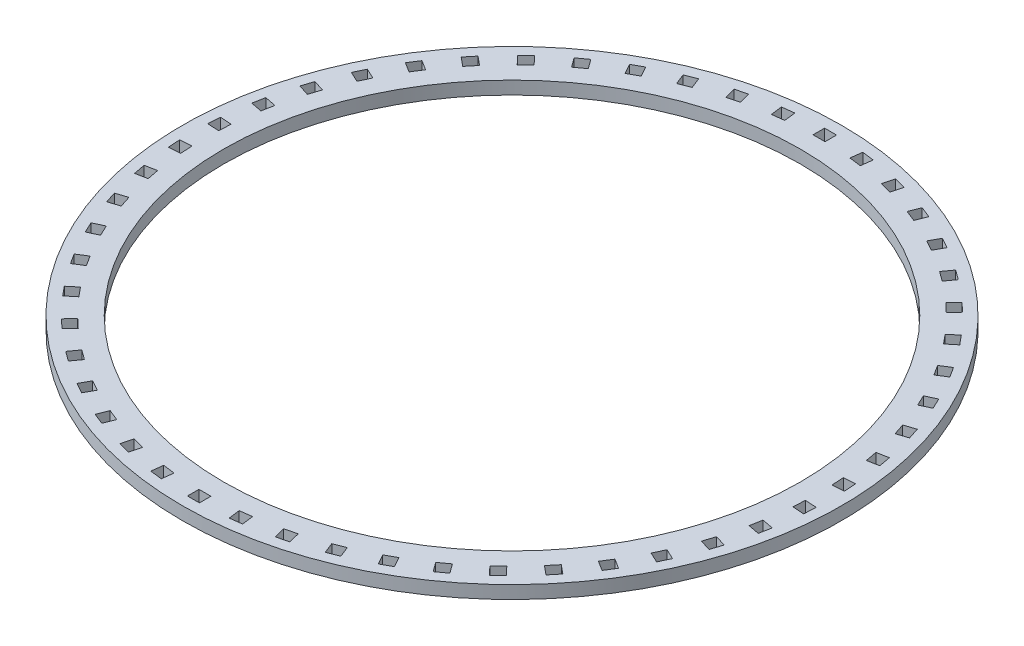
SolidWorks part; units mm, degrees
ref_plane "Front Plane" through (0, 0, 0) normal (0, 0, 1) x (1, 0, 0)
ref_plane "Top Plane" through (0, 0, 0) normal (0, 1, 0) x (1, 0, 0)
ref_plane "Right Plane" through (0, 0, 0) normal (1, 0, 0) x (0, 0, -1)
sketch "Sketch1" plane through (0, 0, 0) normal (0, 1, 0) x (1, 0, 0)
  line L0 (0, 0) -> (0, 76.2) construction
  line L1 (16.9777, 71.6901) -> (16.3144, 69.1069)
  line L2 (-1.3843, 73.66) -> (1.3843, 73.66)
  line L3 (-1.3843, 73.66) -> (-1.3843, 70.993)
  line L4 (-1.3843, 70.993) -> (1.3843, 70.993)
  line L5 (1.3843, 73.66) -> (1.3843, 70.993)
  line L6 (-1.3843, 73.66) -> (1.3843, 70.993) construction
  line L7 (-1.3843, 70.993) -> (1.3843, 73.66) construction
  line L8 (16.9777, 71.6901) -> (19.6593, 71.0016)
  line L9 (19.6593, 71.0016) -> (18.9961, 68.4184)
  line L10 (16.3144, 69.1069) -> (18.9961, 68.4184)
  line L11 (34.2729, 65.2156) -> (32.9881, 62.8785)
  line L12 (34.2729, 65.2156) -> (36.699, 63.8819)
  line L13 (36.699, 63.8819) -> (35.4142, 61.5447)
  line L14 (32.9881, 62.8785) -> (35.4142, 61.5447)
  line L15 (49.4146, 54.6434) -> (47.5889, 52.6993)
  line L16 (49.4146, 54.6434) -> (51.4329, 52.7482)
  line L17 (51.4329, 52.7482) -> (49.6072, 50.8041)
  line L18 (47.5889, 52.6993) -> (49.6072, 50.8041)
  line L19 (61.4514, 40.6378) -> (59.1996, 39.2088)
  line L20 (61.4514, 40.6378) -> (62.9349, 38.3002)
  line L21 (62.9349, 38.3002) -> (60.6831, 36.8711)
  line L22 (59.1996, 39.2088) -> (60.6831, 36.8711)
  line L23 (69.6271, 24.0787) -> (67.0906, 23.2546)
  line L24 (69.6271, 24.0787) -> (70.4826, 21.4456)
  line L25 (70.4826, 21.4456) -> (67.9461, 20.6215)
  line L26 (67.0906, 23.2546) -> (67.9461, 20.6215)
  line L27 (73.4277, 6.0067) -> (70.766, 5.8393)
  line L28 (73.4277, 6.0067) -> (73.6016, 3.2436)
  line L29 (73.6016, 3.2436) -> (70.9398, 3.0761)
  line L30 (70.766, 5.8393) -> (70.9398, 3.0761)
  line L31 (72.6147, -12.4427) -> (69.9949, -11.943)
  line L32 (72.6147, -12.4427) -> (72.0959, -15.1623)
  line L33 (72.0959, -15.1623) -> (69.4761, -14.6625)
  line L34 (69.9949, -11.943) -> (69.4761, -14.6625)
  line L35 (67.239, -30.1104) -> (64.8258, -28.9748)
  line L36 (67.239, -30.1104) -> (66.0602, -32.6155)
  line L37 (66.0602, -32.6155) -> (63.647, -31.4799)
  line L38 (64.8258, -28.9748) -> (63.647, -31.4799)
  line L39 (57.6384, -45.886) -> (55.5834, -44.186)
  line L40 (57.6384, -45.886) -> (55.8736, -48.0193)
  line L41 (55.8736, -48.0193) -> (53.8187, -46.3193)
  line L42 (55.5834, -44.186) -> (53.8187, -46.3193)
  line L43 (44.4162, -58.7785) -> (42.8486, -56.6209)
  line L44 (44.4162, -58.7785) -> (42.1763, -60.4059)
  line L45 (42.1763, -60.4059) -> (40.6087, -58.2482)
  line L46 (42.8486, -56.6209) -> (40.6087, -58.2482)
  line L47 (28.4031, -67.9777) -> (27.4214, -65.498)
  line L48 (28.4031, -67.9777) -> (25.829, -68.9969)
  line L49 (25.829, -68.9969) -> (24.8472, -66.5172)
  line L50 (27.4214, -65.498) -> (24.8472, -66.5172)
  line L51 (10.6054, -72.9057) -> (10.2712, -70.2597)
  line L52 (10.6054, -72.9057) -> (7.8587, -73.2527)
  line L53 (7.8587, -73.2527) -> (7.5244, -70.6067)
  line L54 (10.2712, -70.2597) -> (7.5244, -70.6067)
  line L55 (-7.8587, -73.2527) -> (-7.5244, -70.6067)
  line L56 (-7.8587, -73.2527) -> (-10.6054, -72.9057)
  line L57 (-10.6054, -72.9057) -> (-10.2712, -70.2597)
  line L58 (-7.5244, -70.6067) -> (-10.2712, -70.2597)
  line L59 (-25.829, -68.9969) -> (-24.8472, -66.5172)
  line L60 (-25.829, -68.9969) -> (-28.4031, -67.9777)
  line L61 (-28.4031, -67.9777) -> (-27.4214, -65.498)
  line L62 (-24.8472, -66.5172) -> (-27.4214, -65.498)
  line L63 (-42.1763, -60.4059) -> (-40.6087, -58.2482)
  line L64 (-42.1763, -60.4059) -> (-44.4162, -58.7785)
  line L65 (-44.4162, -58.7785) -> (-42.8486, -56.6209)
  line L66 (-40.6087, -58.2482) -> (-42.8486, -56.6209)
  line L67 (-55.8736, -48.0193) -> (-53.8187, -46.3193)
  line L68 (-55.8736, -48.0193) -> (-57.6384, -45.886)
  line L69 (-57.6384, -45.886) -> (-55.5834, -44.186)
  line L70 (-53.8187, -46.3193) -> (-55.5834, -44.186)
  line L71 (-66.0602, -32.6155) -> (-63.647, -31.4799)
  line L72 (-66.0602, -32.6155) -> (-67.239, -30.1104)
  line L73 (-67.239, -30.1104) -> (-64.8258, -28.9748)
  line L74 (-63.647, -31.4799) -> (-64.8258, -28.9748)
  line L75 (-72.0959, -15.1623) -> (-69.4761, -14.6625)
  line L76 (-72.0959, -15.1623) -> (-72.6147, -12.4427)
  line L77 (-72.6147, -12.4427) -> (-69.9949, -11.943)
  line L78 (-69.4761, -14.6625) -> (-69.9949, -11.943)
  line L79 (-73.6016, 3.2436) -> (-70.9398, 3.0761)
  line L80 (-73.6016, 3.2436) -> (-73.4277, 6.0067)
  line L81 (-73.4277, 6.0067) -> (-70.766, 5.8393)
  line L82 (-70.9398, 3.0761) -> (-70.766, 5.8393)
  line L83 (-70.4826, 21.4456) -> (-67.9461, 20.6215)
  line L84 (-70.4826, 21.4456) -> (-69.6271, 24.0787)
  line L85 (-69.6271, 24.0787) -> (-67.0906, 23.2546)
  line L86 (-67.9461, 20.6215) -> (-67.0906, 23.2546)
  line L87 (-62.9349, 38.3002) -> (-60.6831, 36.8711)
  line L88 (-62.9349, 38.3002) -> (-61.4514, 40.6378)
  line L89 (-61.4514, 40.6378) -> (-59.1996, 39.2088)
  line L90 (-60.6831, 36.8711) -> (-59.1996, 39.2088)
  line L91 (-51.4329, 52.7482) -> (-49.6072, 50.8041)
  line L92 (-51.4329, 52.7482) -> (-49.4146, 54.6434)
  line L93 (-49.4146, 54.6434) -> (-47.5889, 52.6993)
  line L94 (-49.6072, 50.8041) -> (-47.5889, 52.6993)
  line L95 (-36.699, 63.8819) -> (-35.4142, 61.5447)
  line L96 (-36.699, 63.8819) -> (-34.2729, 65.2156)
  line L97 (-34.2729, 65.2156) -> (-32.9881, 62.8785)
  line L98 (-35.4142, 61.5447) -> (-32.9881, 62.8785)
  line L99 (-19.6593, 71.0016) -> (-18.9961, 68.4184)
  line L100 (-19.6593, 71.0016) -> (-16.9777, 71.6901)
  line L101 (-16.9777, 71.6901) -> (-16.3144, 69.1069)
  line L102 (-18.9961, 68.4184) -> (-16.3144, 69.1069)
  line L103 (0, 0) -> (0, -76.2) construction
  line L104 (-19.6593, -71.0016) -> (-18.9961, -68.4184)
  line L105 (-1.3843, -73.66) -> (1.3843, -73.66)
  line L106 (-1.3843, -73.66) -> (-1.3843, -70.993)
  line L107 (-1.3843, -70.993) -> (1.3843, -70.993)
  line L108 (1.3843, -73.66) -> (1.3843, -70.993)
  line L109 (-1.3843, -73.66) -> (1.3843, -70.993) construction
  line L110 (-1.3843, -70.993) -> (1.3843, -73.66) construction
  line L111 (-19.6593, -71.0016) -> (-16.9777, -71.6901)
  line L112 (-16.9777, -71.6901) -> (-16.3144, -69.1069)
  line L113 (-18.9961, -68.4184) -> (-16.3144, -69.1069)
  line L114 (-36.699, -63.8819) -> (-35.4142, -61.5447)
  line L115 (-36.699, -63.8819) -> (-34.2729, -65.2156)
  line L116 (-34.2729, -65.2156) -> (-32.9881, -62.8785)
  line L117 (-35.4142, -61.5447) -> (-32.9881, -62.8785)
  line L118 (-51.4329, -52.7482) -> (-49.6072, -50.8041)
  line L119 (-51.4329, -52.7482) -> (-49.4146, -54.6434)
  line L120 (-49.4146, -54.6434) -> (-47.5889, -52.6993)
  line L121 (-49.6072, -50.8041) -> (-47.5889, -52.6993)
  line L122 (-62.9349, -38.3002) -> (-60.6831, -36.8711)
  line L123 (-62.9349, -38.3002) -> (-61.4514, -40.6378)
  line L124 (-61.4514, -40.6378) -> (-59.1996, -39.2088)
  line L125 (-60.6831, -36.8711) -> (-59.1996, -39.2088)
  line L126 (-70.4826, -21.4456) -> (-67.9461, -20.6215)
  line L127 (-70.4826, -21.4456) -> (-69.6271, -24.0787)
  line L128 (-69.6271, -24.0787) -> (-67.0906, -23.2546)
  line L129 (-67.9461, -20.6215) -> (-67.0906, -23.2546)
  line L130 (-73.6016, -3.2436) -> (-70.9398, -3.0761)
  line L131 (-73.6016, -3.2436) -> (-73.4277, -6.0067)
  line L132 (-73.4277, -6.0067) -> (-70.766, -5.8393)
  line L133 (-70.9398, -3.0761) -> (-70.766, -5.8393)
  line L134 (-72.0959, 15.1623) -> (-69.4761, 14.6625)
  line L135 (-72.0959, 15.1623) -> (-72.6147, 12.4427)
  line L136 (-72.6147, 12.4427) -> (-69.9949, 11.943)
  line L137 (-69.4761, 14.6625) -> (-69.9949, 11.943)
  line L138 (-66.0602, 32.6155) -> (-63.647, 31.4799)
  line L139 (-66.0602, 32.6155) -> (-67.239, 30.1104)
  line L140 (-67.239, 30.1104) -> (-64.8258, 28.9748)
  line L141 (-63.647, 31.4799) -> (-64.8258, 28.9748)
  line L142 (-55.8736, 48.0193) -> (-53.8187, 46.3193)
  line L143 (-55.8736, 48.0193) -> (-57.6384, 45.886)
  line L144 (-57.6384, 45.886) -> (-55.5834, 44.186)
  line L145 (-53.8187, 46.3193) -> (-55.5834, 44.186)
  line L146 (-42.1763, 60.4059) -> (-40.6087, 58.2482)
  line L147 (-42.1763, 60.4059) -> (-44.4162, 58.7785)
  line L148 (-44.4162, 58.7785) -> (-42.8486, 56.6209)
  line L149 (-40.6087, 58.2482) -> (-42.8486, 56.6209)
  line L150 (-25.829, 68.9969) -> (-24.8472, 66.5172)
  line L151 (-25.829, 68.9969) -> (-28.4031, 67.9777)
  line L152 (-28.4031, 67.9777) -> (-27.4214, 65.498)
  line L153 (-24.8472, 66.5172) -> (-27.4214, 65.498)
  line L154 (-7.8587, 73.2527) -> (-7.5244, 70.6067)
  line L155 (-7.8587, 73.2527) -> (-10.6054, 72.9057)
  line L156 (-10.6054, 72.9057) -> (-10.2712, 70.2597)
  line L157 (-7.5244, 70.6067) -> (-10.2712, 70.2597)
  line L158 (10.6054, 72.9057) -> (10.2712, 70.2597)
  line L159 (10.6054, 72.9057) -> (7.8587, 73.2527)
  line L160 (7.8587, 73.2527) -> (7.5244, 70.6067)
  line L161 (10.2712, 70.2597) -> (7.5244, 70.6067)
  line L162 (28.4031, 67.9777) -> (27.4214, 65.498)
  line L163 (28.4031, 67.9777) -> (25.829, 68.9969)
  line L164 (25.829, 68.9969) -> (24.8472, 66.5172)
  line L165 (27.4214, 65.498) -> (24.8472, 66.5172)
  line L166 (44.4162, 58.7785) -> (42.8486, 56.6209)
  line L167 (44.4162, 58.7785) -> (42.1763, 60.4059)
  line L168 (42.1763, 60.4059) -> (40.6087, 58.2482)
  line L169 (42.8486, 56.6209) -> (40.6087, 58.2482)
  line L170 (57.6384, 45.886) -> (55.5834, 44.186)
  line L171 (57.6384, 45.886) -> (55.8736, 48.0193)
  line L172 (55.8736, 48.0193) -> (53.8187, 46.3193)
  line L173 (55.5834, 44.186) -> (53.8187, 46.3193)
  line L174 (67.239, 30.1104) -> (64.8258, 28.9748)
  line L175 (67.239, 30.1104) -> (66.0602, 32.6155)
  line L176 (66.0602, 32.6155) -> (63.647, 31.4799)
  line L177 (64.8258, 28.9748) -> (63.647, 31.4799)
  line L178 (72.6147, 12.4427) -> (69.9949, 11.943)
  line L179 (72.6147, 12.4427) -> (72.0959, 15.1623)
  line L180 (72.0959, 15.1623) -> (69.4761, 14.6625)
  line L181 (69.9949, 11.943) -> (69.4761, 14.6625)
  line L182 (73.4277, -6.0067) -> (70.766, -5.8393)
  line L183 (73.4277, -6.0067) -> (73.6016, -3.2436)
  line L184 (73.6016, -3.2436) -> (70.9398, -3.0761)
  line L185 (70.766, -5.8393) -> (70.9398, -3.0761)
  line L186 (69.6271, -24.0787) -> (67.0906, -23.2546)
  line L187 (69.6271, -24.0787) -> (70.4826, -21.4456)
  line L188 (70.4826, -21.4456) -> (67.9461, -20.6215)
  line L189 (67.0906, -23.2546) -> (67.9461, -20.6215)
  line L190 (61.4514, -40.6378) -> (59.1996, -39.2088)
  line L191 (61.4514, -40.6378) -> (62.9349, -38.3002)
  line L192 (62.9349, -38.3002) -> (60.6831, -36.8711)
  line L193 (59.1996, -39.2088) -> (60.6831, -36.8711)
  line L194 (49.4146, -54.6434) -> (47.5889, -52.6993)
  line L195 (49.4146, -54.6434) -> (51.4329, -52.7482)
  line L196 (51.4329, -52.7482) -> (49.6072, -50.8041)
  line L197 (47.5889, -52.6993) -> (49.6072, -50.8041)
  line L198 (34.2729, -65.2156) -> (32.9881, -62.8785)
  line L199 (34.2729, -65.2156) -> (36.699, -63.8819)
  line L200 (36.699, -63.8819) -> (35.4142, -61.5447)
  line L201 (32.9881, -62.8785) -> (35.4142, -61.5447)
  line L202 (16.9777, -71.6901) -> (16.3144, -69.1069)
  line L203 (16.9777, -71.6901) -> (19.6593, -71.0016)
  line L204 (19.6593, -71.0016) -> (18.9961, -68.4184)
  line L205 (16.3144, -69.1069) -> (18.9961, -68.4184)
  circle A0 centre (0, 0) radius 76.2
  circle A1 centre (0, 0) radius 66.675
  point P4 (0, 72.3265)
  point P10 (0, -72.3265)
  point P109 (0, 0)
  point P212 (0, 0)
  dimension "D1" = 152.4
  dimension "D2" = 133.35
  dimension "D3" = 2.54
  dimension "D4" = 2.667
  dimension "D5" = 2.7686
  dimension "D7" = 2.54
  dimension "D8" = 2.667
  dimension "D9" = 2.7686
  dimension "D6" = 25
  dimension "D10" = 25
extrude "Boss-Extrude1" add sketch "Sketch1" along normal blind 2.9972
